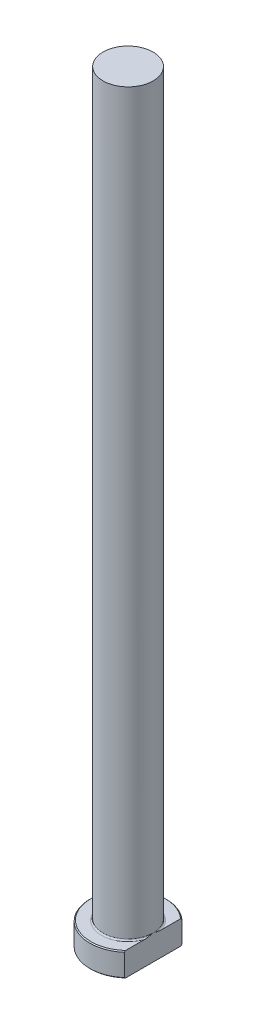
SolidWorks part; units mm, degrees
ref_plane "Front Plane" through (0, 0, 0) normal (0, 0, 1) x (1, 0, 0)
ref_plane "Top Plane" through (0, 0, 0) normal (0, 1, 0) x (1, 0, 0)
ref_plane "Right Plane" through (0, 0, 0) normal (1, 0, 0) x (0, 0, -1)
sketch "Sketch1" plane through (0, 0, 0) normal (0, 0, 1) x (1, 0, 0)
  line L0 (0, 259.9588) -> (0, -15.1925) construction
  line L1 (0, 0) -> (-8, 0)
  line L2 (-8, 0) -> (-8, 5)
  line L3 (-8, 5) -> (-5.25, 5)
  line L4 (-5.25, 5) -> (-5.25, 160)
  line L5 (-5.25, 160) -> (0, 160)
  line L6 (0, 160) -> (0, 0)
  dimension "L" = 160
  dimension "H" = 16
  dimension "T" = 5
  dimension "D" = 10.5
revolve "Revolve1" add sketch "Sketch1" angle 360 about L0
chamfer "Chamfer1" distance 0.2 angle 45 2 edges at (0, 5, 8) (0, 0, 8)
fillet "Fillet1" radius 0.3 1 edges at (0, 5, 5.25)
sketch "Sketch2" plane through (0, 0, 0) normal (0, 1, 0) x (1, 0, 0)
  line L0 (5.25, 6.0363) -> (5.25, -6.0363)
  circle A0 centre (0, 0) radius 8 construction
  arc A1 (5.25, -6.0363) -> (5.25, 6.0363) centre (0, 0) ccw
  circle A2 centre (0, 0) radius 5.25 construction
extrude "KEY" cut sketch "Sketch2" along normal through all
